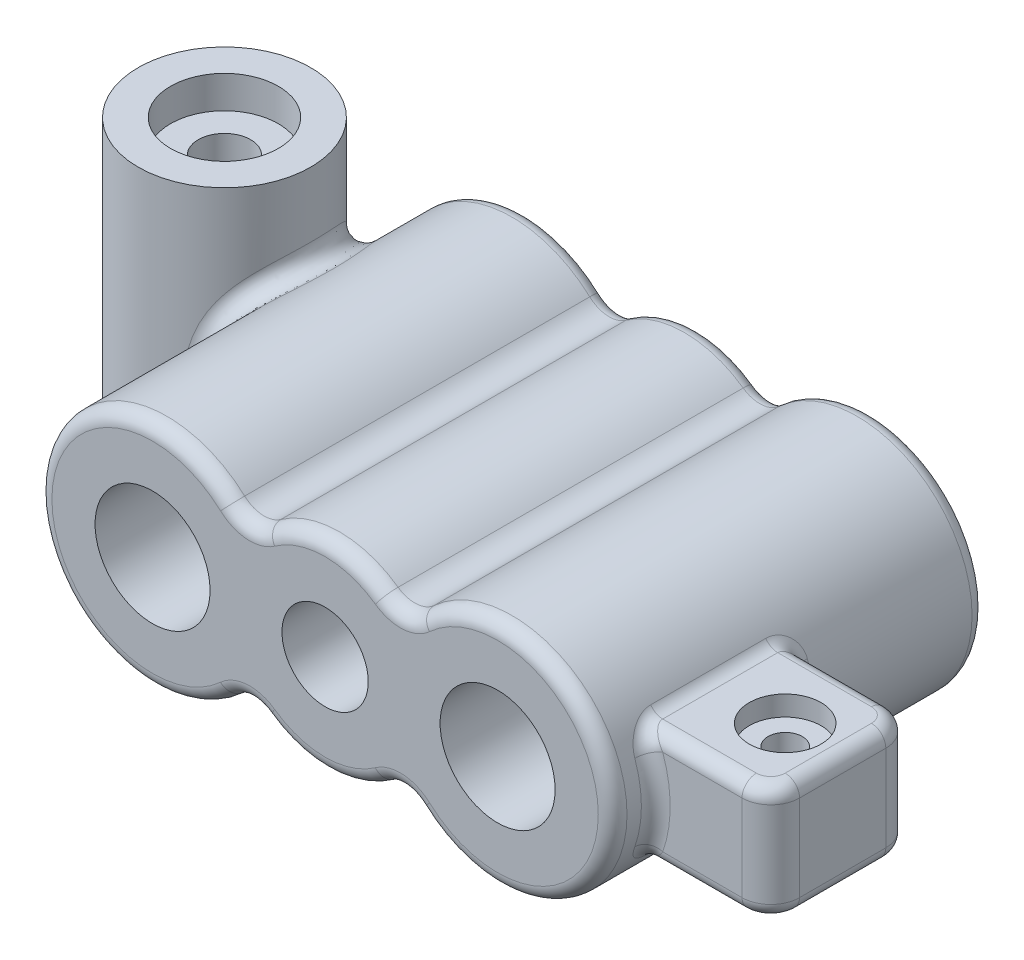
SolidWorks part; units mm, degrees
ref_plane "Front Plane" through (0, 0, 0) normal (0, 0, 1) x (1, 0, 0)
ref_plane "Top Plane" through (0, 0, 0) normal (0, 1, 0) x (1, 0, 0)
ref_plane "Right Plane" through (0, 0, 0) normal (1, 0, 0) x (0, 0, -1)
sketch "Sketch1" plane through (0, 0, 0) normal (0, 0, 1) x (1, 0, 0)
  arc A0 (-6.4761, -9.1084) -> (6.4761, -9.1084) centre (0, 0) ccw
  arc A1 (10.4628, -9.3568) -> (10.4628, 9.3568) centre (19.05, 0) ccw
  arc A2 (-10.4628, 9.3568) -> (-10.4628, -9.3568) centre (-19.05, 0) ccw
  arc A3 (6.4761, 9.1084) -> (-6.4761, 9.1084) centre (0, 0) ccw
  arc A4 (-10.4628, 9.3568) -> (-6.4761, 9.1084) centre (-8.316, 11.696) ccw
  arc A5 (10.4628, 9.3568) -> (6.4761, 9.1084) centre (8.316, 11.696) cw
  arc A6 (-10.4628, -9.3568) -> (-6.4761, -9.1084) centre (-8.316, -11.696) cw
  arc A7 (10.4628, -9.3568) -> (6.4761, -9.1084) centre (8.316, -11.696) ccw
  point P12 (8.57, 7.1735)
  dimension "OD" = 25.4
  dimension "D4" = 22.352
  dimension "D5" = 3.175
  dimension "D1" = 38.1
  dimension "D2" = 19.05
extrude "Extrude1" add sketch "Sketch1" along normal mid plane 41.275
sketch "Sketch2" plane through (0, 0, 0) normal (0, 1, 0) x (1, 0, 0)
  line L1 (10.4628, -20.6375) -> (31.75, -20.6375) construction
  line L3 (0, 0) -> (44.45, 0)
  line L4 (0, 0) -> (0, -15.875)
  line L5 (0, -15.875) -> (44.45, -15.875)
  line L6 (44.45, 0) -> (44.45, -15.875)
  dimension "D2" = 44.45
  dimension "D1" = 4.7625
extrude "Extrude2" add sketch "Sketch2" along normal mid plane 12.7
fillet "Fillet1" radius 3.175 2 edges at (44.45, 0, 0) (44.45, 0, 15.875)
sketch "Sketch3" plane through (0, 0, 0) normal (0, 1, 0) x (1, 0, 0)
  circle A0 centre (-38.1, 6.35) radius 9.525
  dimension "D2" = 19.05
  dimension "D1" = 38.1
  dimension "D3" = 6.35
extrude "Extrude3" add sketch "Sketch3" along normal mid plane 38.1
sketch "Sketch4" plane through (0, 0, 20.6375) normal (0, 0, 1) x (1, 0, 0)
  circle A0 centre (-19.05, 0) radius 6.35
  dimension "ID" = 12.7
extrude "Cut-Extrude1" cut sketch "Sketch4" against normal through all
sketch "Sketch5" plane through (19.9268, 0.3998, 20.6375) normal (0, 0, 1) x (1, 0, 0)
  circle A0 centre (-19.9268, -0.3998) radius 4.7625
  dimension "D1" = 9.525
extrude "Cut-Extrude2" cut sketch "Sketch5" against normal through all
sketch "Sketch6" plane through (38.7891, -0.1741, 20.6375) normal (0, 0, 1) x (1, 0, 0)
  circle A0 centre (-19.7391, 0.1741) radius 6.35
extrude "Cut-Extrude3" cut sketch "Sketch6" against normal through all
hole_wizard "CBORE for #12 Binding Head Machine Screw1" positions "Sketch8" profile "Sketch7" counterbore size "#12" standard "Ansi Inch"
sketch "Sketch8" plane through (0, 19.05, 0) normal (0, 1, 0) x (-1, 0, 0)
  point P0 (38.1, -6.35)
sketch "Sketch7" plane through (-38.1, 19.05, -6.35) normal (1, 0, 0) x (0, 0, 1)
  line L0 (0, 0) -> (0, 38.1)
  line L1 (0, 38.1) -> (2.8956, 38.1)
  line L3 (2.8956, 38.1) -> (2.8956, 3.5814)
  line L4 (2.8956, 3.5814) -> (5.9538, 3.5814)
  line L5 (5.9538, 3.5814) -> (5.9538, 0)
  line L7 (5.9538, 0) -> (0, 0)
  line L11 (0, -6.35) -> (0, 107.95) construction
  dimension "Thru Hole Dia." = 5.7912
  dimension "Thru Hole Depth" = 38.1
  dimension "C'Bore Dia." = 11.9075
  dimension "C'Bore Depth" = 3.5814
hole_wizard "CBORE for #6 Binding Head Machine Screw1" positions "Sketch9" profile "Sketch10" counterbore size "#6" standard "Ansi Inch"
sketch "Sketch9" plane through (74.0329, 6.35, 14.4097) normal (0, 1, 0) x (-1, 0, 0)
  line L0 (43.9843, 1.4653) -> (32.7579, 1.4653) construction
  circle A0 centre (112.1329, -20.7597) radius 2.8956 construction
  point P0 (35.9329, -6.4722)
  dimension "D2" = 76.2
  dimension "D1" = 7.9375
sketch "Sketch10" plane through (38.1, 6.35, 7.9375) normal (1, 0, 0) x (0, 0, 1)
  line L0 (0, 0) -> (0, 25.4)
  line L1 (0, 25.4) -> (1.8986, 25.4)
  line L3 (1.8986, 25.4) -> (1.8987, 2.2098)
  line L4 (1.8987, 2.2098) -> (3.9687, 2.2098)
  line L5 (3.9687, 2.2098) -> (3.9687, 0)
  line L7 (3.9687, 0) -> (0, 0)
  line L11 (0, -6.35) -> (0, 107.95) construction
  dimension "Thru Hole Dia." = 3.7973
  dimension "Thru Hole Depth" = 25.4
  dimension "C'Bore Dia." = 7.9375
  dimension "C'Bore Depth" = 2.2098
fillet "Fillet2" radius 1.5875 10 edges at (35.6618, -6.35, 15.875) (35.6618, 6.35, 15.875) (35.6618, -6.35, 0) (35.6618, 6.35, 0) (44.45, -6.35, 7.9375) (43.5201, -6.35, 14.9451) (43.5201, -6.35, 0.9299) (44.45, 6.35, 7.9375) (43.5201, 6.35, 14.9451) (43.5201, 6.35, 0.9299)
fillet "Fillet3" radius 1.5875 9 edges at (30.3358, -5.8241, 0.4072) (30.2051, -6.0706, 15.1869) (30.2051, 6.0706, 0.6881) (30.3358, 5.8241, 15.4678) (-31.6955, -1.1751, -13.4004) (31.75, 0, 0) (30.0485, -6.35, 7.9375) (31.75, 0, 15.875) (30.0485, 6.35, 7.9375)
fillet "Fillet4" radius 1.5875 16 edges at (-8.5134, -8.5271, 20.6375) (0, -11.176, 20.6375) (8.5134, -8.5271, 20.6375) (31.75, 0, 20.6375) (8.5134, 8.5271, 20.6375) (0, 11.176, 20.6375) (-8.5134, 8.5271, 20.6375) (0, 11.176, -20.6375) (-31.75, 0, 20.6375) (8.5134, 8.5271, -20.6375) (31.75, 0, -20.6375) (8.5134, -8.5271, -20.6375) (0, -11.176, -20.6375) (-8.5134, -8.5271, -20.6375) (-31.75, 0, -20.6375) (-8.5134, 8.5271, -20.6375)
